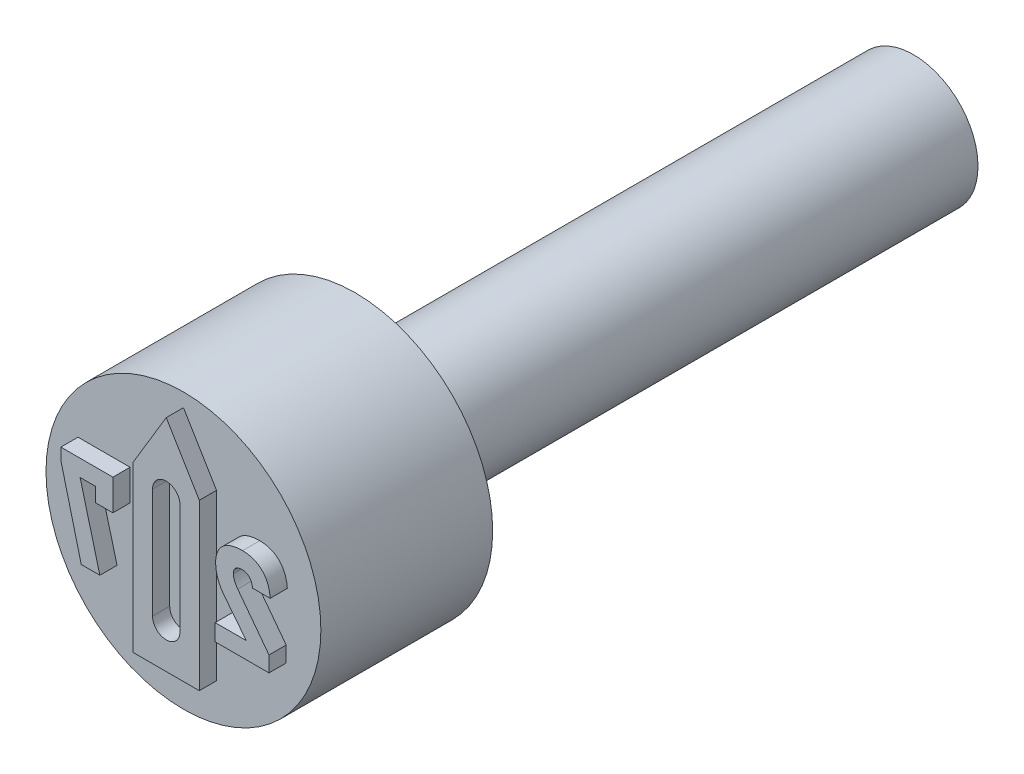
SolidWorks part; units mm, degrees
ref_plane "Front Plane" through (0, 0, 0) normal (0, 0, 1) x (1, 0, 0)
ref_plane "Top Plane" through (0, 0, 0) normal (0, 1, 0) x (1, 0, 0)
ref_plane "Right Plane" through (0, 0, 0) normal (1, 0, 0) x (0, 0, -1)
sketch "Sketch2" plane through (0, 0, 0) normal (1, 0, 0) x (0, 0, -1)
  line L0 (0.4039, 0) -> (50000.4039, 0) construction
  line L6 (0, 3.2) -> (0, 0)
  line L7 (4, 3.2) -> (0, 3.2)
  line L8 (4, 1.5) -> (4, 3.2)
  line L9 (17, 1.5) -> (4, 1.5)
  line L10 (17, 0) -> (17, 1.5)
  line L11 (0, 0) -> (17, 0)
  dimension "D1" = 6.4
  dimension "D2" = 3
  dimension "D3" = 17
  dimension "D4" = 4
revolve "Revolve1" add sketch "Sketch2" angle 360 about L0
sketch "Sketch3" plane through (0, 0, 0) normal (0, 0, 1) x (1, 0, 0)
  line L0 (0, 0.1879) -> (0, 150000.1879) construction
  line L1 (-0.77, -2.24) -> (0.77, -2.24)
  line L2 (0.77, -2.24) -> (0.77, 1.6)
  line L3 (0.77, 1.6) -> (0, 2.8815)
  line L4 (0, 2.8815) -> (-0.77, 1.6)
  line L5 (-0.77, 1.6) -> (-0.77, -2.24)
  text T0 "2    7" font "Bahnschrift" height 2.13
  dimension "D1" = 3.84
  dimension "D2" = 1.54
  dimension "D3" = 0.77
  dimension "D4" = 62
  dimension "D5" = 2.24
  dimension "D6" = 1.07
  dimension "D7" = 2.55
extrude "Boss-Extrude1" add sketch "Sketch3" along normal blind 0.4
sketch "Sketch4" plane through (0, 0, 0.4) normal (0, 0, 1) x (1, 0, 0)
  line L2 (-0.32, 1.28) -> (-0.32, -1.28)
  line L4 (0.32, 1.28) -> (0.32, -1.28)
  arc A0 (0.32, 1.28) -> (-0.32, 1.28) centre (0, 1.28) ccw
  arc A1 (-0.32, -1.28) -> (0.32, -1.28) centre (0, -1.28) ccw
  dimension "D1" = 2.56
  dimension "D2" = 1.28
  dimension "D3" = 0.64
  dimension "D4" = 0.32
extrude "Cut-Extrude1" cut sketch "Sketch4" against normal blind 0.4
